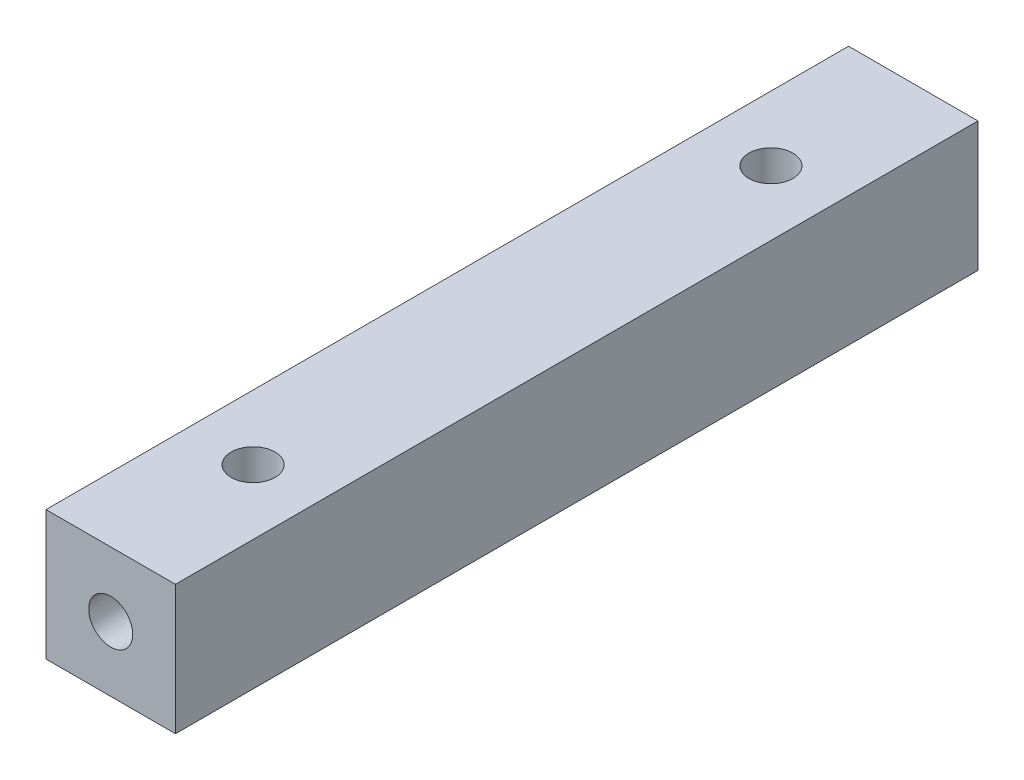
SolidWorks part; units mm, degrees
ref_plane "Plan de face" through (0, 0, 0) normal (0, 0, 1) x (1, 0, 0)
ref_plane "Plan de dessus" through (0, 0, 0) normal (0, 1, 0) x (1, 0, 0)
ref_plane "Plan de droite" through (0, 0, 0) normal (1, 0, 0) x (0, 0, -1)
sketch "Esquisse1" plane through (0, 0, 0) normal (0, 0, 1) x (1, 0, 0)
  line L1 (-10, 0) -> (10, 0)
  line L2 (-10, 0) -> (-10, 20)
  line L3 (-10, 20) -> (10, 20)
  line L4 (10, 0) -> (10, 20)
  dimension "D1" = 20
  dimension "D2" = 20
extrude "Extrusion1" add sketch "Esquisse1" along normal mid plane 124
hole_wizard "Trou taraudé M81" positions "Esquisse3" profile "Esquisse2" tap size "M8" standard "ISO"
sketch "Esquisse3" plane through (0, 0, 62) normal (0, 0, 1) x (1, 0, 0)
  line L0 (-10, 0) -> (10, 0) construction
  line L1 (-10, 20) -> (-10, 0) construction
  point P0 (0, 10)
  dimension "D1" = 10
  dimension "D2" = 10
sketch "Esquisse2" plane through (0, 10, 62) normal (1, 0, 0) x (0, -1, 0)
  line L0 (0, 0) -> (0, 24.2929)
  line L1 (0, 24.2929) -> (3.4, 22.25)
  line L2 (3.4, 22.25) -> (3.4, 0)
  line L5 (3.4, 0) -> (0, 0)
  line L10 (0, 24.2929) -> (-3.4, 22.25) construction
  line L11 (0, -6.35) -> (0, 107.95) construction
  dimension "Diamètre du trou pour taraudage" = 6.8
  dimension "Profondeur du trou pour taraudage" = 22.25
  dimension "Angle de pointe" = 118
hole_wizard "Trou taraudé M82" positions "Esquisse5" profile "Esquisse4" tap size "M8" standard "ISO"
sketch "Esquisse5" plane through (0, 20, 0) normal (0, 1, 0) x (-1, 0, 0)
  point P0 (0, 40)
  dimension "D1" = 40
sketch "Esquisse4" plane through (0, 20, 40) normal (1, 0, 0) x (0, 0, 1)
  line L0 (0, 0) -> (0, 20)
  line L1 (0, 20) -> (3.4, 20)
  line L2 (3.4, 20) -> (3.4, 0)
  line L5 (3.4, 0) -> (0, 0)
  line L11 (0, -6.35) -> (0, 107.95) construction
  dimension "Diamètre du trou pour taraudage jusqu'au prochain" = 6.8
  dimension "Profondeur du trou pour taraudage jusqu'au prochain" = 20
mirror "Symétrie1" about plane through (0, 0, 0) normal (0, 0, 1) of "Trou taraudé M82", "Trou taraudé M81"
